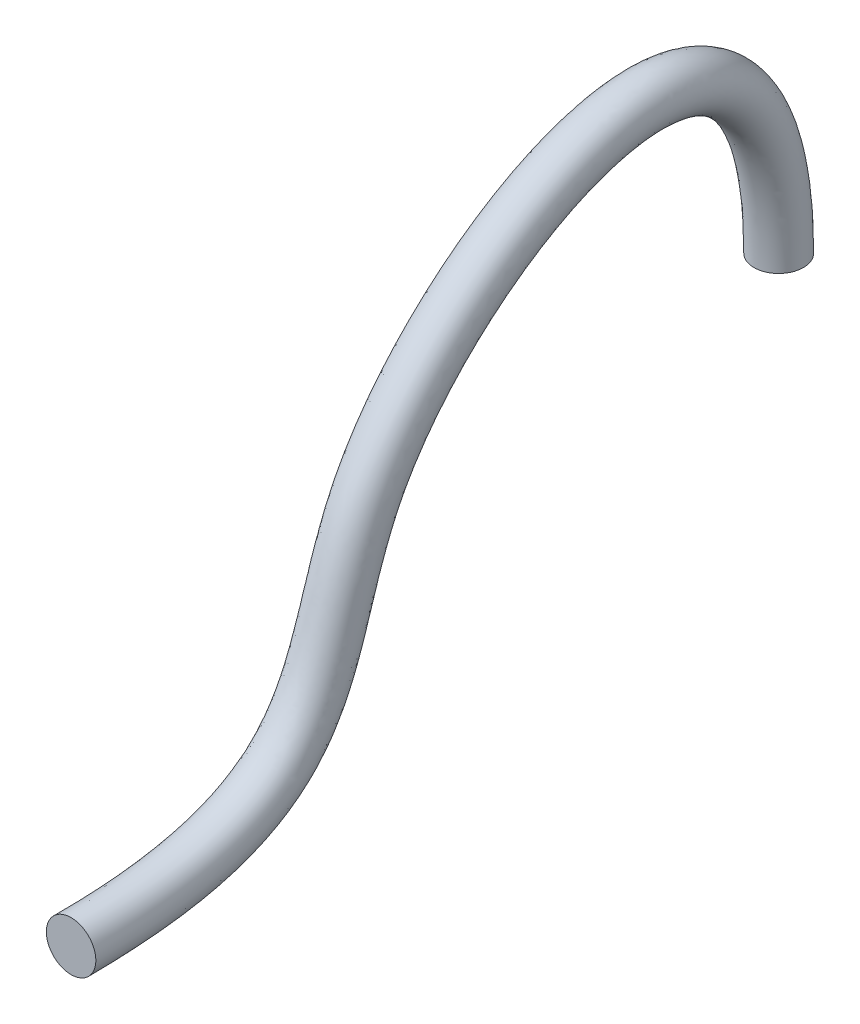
SolidWorks part; units mm, degrees
ref_plane "正面" through (0, 0, 0) normal (0, 0, 1) x (1, 0, 0)
ref_plane "平面" through (0, 0, 0) normal (0, 1, 0) x (1, 0, 0)
ref_plane "右側面" through (0, 0, 0) normal (1, 0, 0) x (0, 0, -1)
sketch "ｽｹｯﾁ1" plane through (0, 0, 0) normal (1, 0, 0) x (0, 0, -1)
  line L0 (-620, 840) -> (-620, 850) construction
  line L1 (-477, 875) -> (-477, 895) construction
  line L2 (-630, 845) -> (-620, 845) construction
  spline S0 degree 3 poles (-620, 845) (-564.4668, 845) (-583.9717, 910.2962) (-477, 963.6372) (-477, 894.7494) knots 0 0 0 0 0.397322 1 1 1 1
  spline S1 degree 2 poles (-472, 895) (-477, 894.5) (-482, 895) knots 0 0 0 1 1 1 weights 0.045 0.05 0.055 construction
  spline S2 degree 2 poles (-472, 895) (-477, 894.5) (-482, 895) knots 0 0 0 1 1 1 weights 0.045 0.05 0.055 construction
  point P10 (0, 0)
  dimension "D1" = 60
  dimension "D2" = 60
  dimension "D3" = 50
  dimension "D4" = 40
ref_plane "平面1" through (0, 845, 620) normal (0, 0, -1) x (-1, 0, 0)
sketch "ｽｹｯﾁ2" plane through (0, 845, 620) normal (0, 0, -1) x (-1, 0, 0)
  circle A0 centre (0, 0) radius 5
  dimension "D1" = 10
sweep "ｽｲｰﾌﾟ1" add profiles "ｽｹｯﾁ2" path "ｽｹｯﾁ1"
